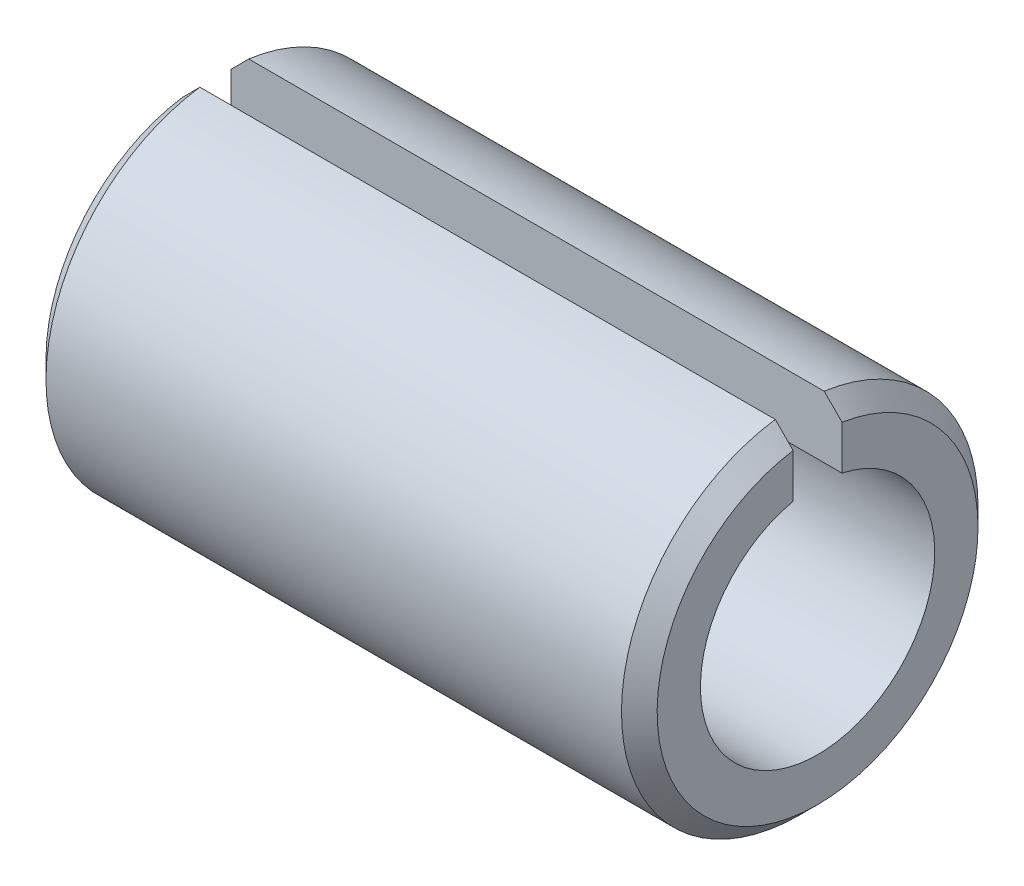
SolidWorks part; units mm, degrees
ref_plane "Plan1" through (0, 0, 0) normal (0, 0, 1) x (1, 0, 0)
ref_plane "Plan2" through (0, 0, 0) normal (0, 1, 0) x (1, 0, 0)
ref_plane "Plan3" through (0, 0, 0) normal (1, 0, 0) x (0, 0, -1)
sketch "Esquisse1" plane through (0, 0, 0) normal (0, 0, 1) x (1, 0, 0)
  line L0 (0, 1.15) -> (0, 1.575)
  line L1 (0, 1.15) -> (6, 1.15)
  line L2 (6, 1.15) -> (6, 1.575)
  line L3 (6, 1.575) -> (5.825, 1.75)
  line L4 (5.825, 1.75) -> (0.175, 1.75)
  line L5 (0.175, 1.75) -> (0, 1.575)
  line L6 (0, 0) -> (6, 0) construction
  dimension "D1" = 6
  dimension "D2" = 1.75
  dimension "D3" = 0.6
  dimension "D4" = 45
  dimension "D5" = 45
  dimension "D6" = 0.175
revolve "Base-Révolution" add sketch "Esquisse1" angle 360 about L6
sketch "Esquisse2" plane through (0, 0, 0) normal (1, 0, 0) x (0, 0, -1)
  line L0 (0, 0) -> (0, 1.75) construction
  line L1 (0.24, 1.7335) -> (0.24, 1.1247)
  line L2 (-0.24, 1.7335) -> (-0.24, 1.1247)
  circle A0 centre (0, 0) radius 1.75 construction
  circle A1 centre (0, 0) radius 1.15 construction
  arc A2 (0.24, 1.1247) -> (-0.24, 1.1247) centre (0, 0) ccw
  arc A3 (0.24, 1.7335) -> (-0.24, 1.7335) centre (0, 0) ccw
  dimension "D1" = 0.24
extrude "Enlèv. mat.-Extru.2" cut sketch "Esquisse2" along normal through all
equation "\"D6@Esquisse1\"=\"D2@Esquisse1\"/10"
equation "\"D1@Esquisse2\"=\"D3@Esquisse1\"/2.5"
